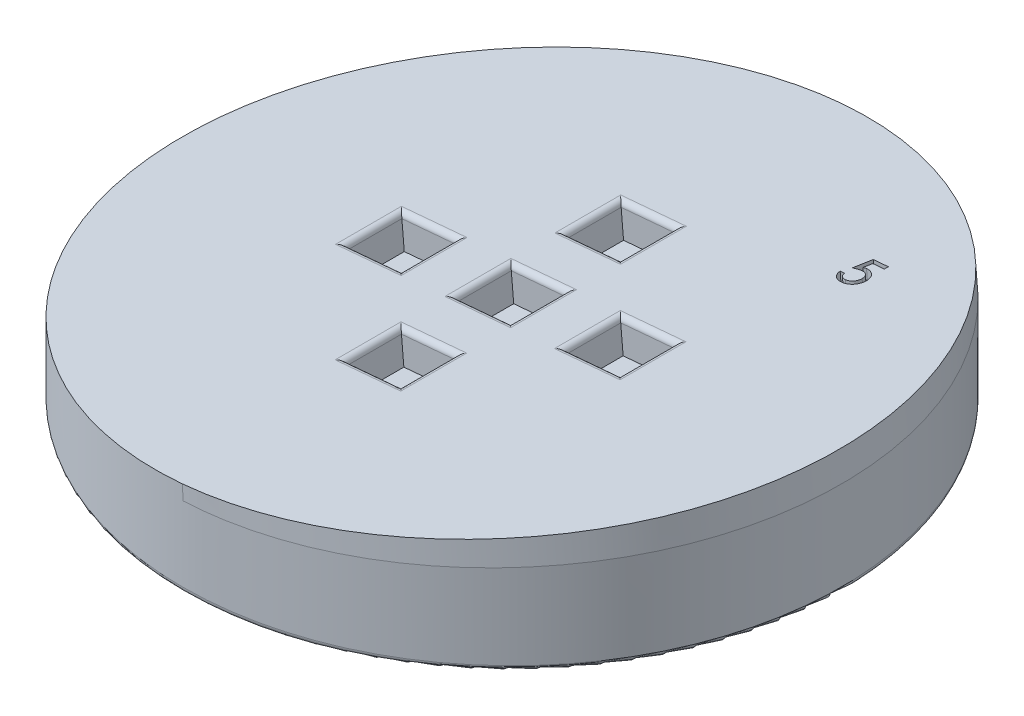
SolidWorks part; units mm, degrees
ref_plane "Front Plane" through (0, 0, 0) normal (0, 0, 1) x (1, 0, 0)
ref_plane "Top Plane" through (0, 0, 0) normal (0, 1, 0) x (1, 0, 0)
ref_plane "Right Plane" through (0, 0, 0) normal (1, 0, 0) x (0, 0, -1)
sketch "Sketch1" plane through (0, 0, 0) normal (0, 1, 0) x (1, 0, 0)
  circle A0 centre (0, 0) radius 30
extrude "Boss-Extrude1" add sketch "Sketch1" along normal blind 50
sketch "Sketch3" plane through (0, 50, 0) normal (0, 1, 0) x (1, 0, 0)
sketch "Sketch4" plane through (0, 0, 0) normal (0, -1, 0) x (-1, 0, 0)
  line L0 (0, 0) -> (-10, 0) construction
  line L1 (0, 0) -> (0, -10) construction
  line L2 (0, 0) -> (0, 10) construction
  line L3 (0, 0) -> (10, 0) construction
  line L5 (-2.5, 2.5) -> (2.5, 2.5)
  line L6 (-2.5, 2.5) -> (-2.5, -2.5)
  line L7 (-2.5, -2.5) -> (2.5, -2.5)
  line L8 (2.5, 2.5) -> (2.5, -2.5)
  line L9 (-2.5, 2.5) -> (2.5, -2.5) construction
  line L10 (-2.5, -2.5) -> (2.5, 2.5) construction
  line L11 (-2.5, -7.5) -> (2.5, -7.5)
  line L12 (-2.5, -7.5) -> (-2.5, -12.5)
  line L13 (-2.5, -12.5) -> (2.5, -12.5)
  line L14 (2.5, -7.5) -> (2.5, -12.5)
  line L15 (-2.5, -7.5) -> (2.5, -12.5) construction
  line L16 (-2.5, -12.5) -> (2.5, -7.5) construction
  line L17 (7.5, 2.5) -> (12.5, 2.5)
  line L18 (7.5, 2.5) -> (7.5, -2.5)
  line L19 (7.5, -2.5) -> (12.5, -2.5)
  line L20 (12.5, 2.5) -> (12.5, -2.5)
  line L21 (7.5, 2.5) -> (12.5, -2.5) construction
  line L22 (7.5, -2.5) -> (12.5, 2.5) construction
  line L23 (-12.5, 2.5) -> (-7.5, 2.5)
  line L24 (-12.5, 2.5) -> (-12.5, -2.5)
  line L25 (-12.5, -2.5) -> (-7.5, -2.5)
  line L26 (-7.5, 2.5) -> (-7.5, -2.5)
  line L27 (-12.5, 2.5) -> (-7.5, -2.5) construction
  line L28 (-12.5, -2.5) -> (-7.5, 2.5) construction
  line L29 (2.5, 7.5) -> (-2.5, 7.5)
  line L30 (2.5, 7.5) -> (2.5, 12.5)
  line L31 (2.5, 12.5) -> (-2.5, 12.5)
  line L32 (-2.5, 7.5) -> (-2.5, 12.5)
  line L33 (2.5, 7.5) -> (-2.5, 12.5) construction
  line L34 (2.5, 12.5) -> (-2.5, 7.5) construction
  dimension "D1" = 5
  dimension "D2" = 5
  dimension "D3" = 5
  dimension "D4" = 5
  dimension "D5" = 5
  dimension "D6" = 5
extrude "Cut-Extrude2" cut sketch "Sketch4" against normal blind 3
fillet "Fillet2" radius 0.5 21 edges at (0, 0, 30) (2.5, 0, 0) (0, 0, 2.5) (-2.5, 0, 0) (0, 0, -2.5) (2.5, 0, 10) (0, 0, 12.5) (-2.5, 0, 10) (0, 0, 7.5) (-7.5, 0, 0) (-10, 0, 2.5) (-12.5, 0, 0) (-10, 0, -2.5) (12.5, 0, 0) (10, 0, 2.5) (7.5, 0, 0) (10, 0, -2.5) (-2.5, 0, -10) (0, 0, -12.5) (2.5, 0, -10) (0, 0, -7.5)
ref_plane "Plane6" through (0, 0, 3.5) normal (0, 0, 1) x (1, 0, 0)
sketch "Sketch13" plane through (0, 0, 3.5) normal (0, 0, 1) x (1, 0, 0)
  line L0 (-30, 6) -> (30, 11.2493)
  line L1 (-30, 50) -> (-30, 0.5) construction
  line L2 (30, 0.5) -> (30, 50) construction
  line L3 (30, 11.2493) -> (30, 50)
  line L4 (30, 50) -> (-30, 50)
  line L5 (-30, 50) -> (-30, 6)
  line L6 (30, 0.5) -> (-30, 0.5) construction
  dimension "D1" = 5.5
  dimension "D2" = 5
extrude "Cut-Extrude10" cut sketch "Sketch13" against normal mid plane 90
ref_plane "Plane4" through (0, 0, -2.5) normal (0, 0, -1) x (-1, 0, 0)
ref_plane "Plane5" through (0, 0, -62.5) normal (0, 0, -1) x (-1, 0, 0)
sketch "Sketch15" plane through (-0.7488, 8.5591, 0) normal (-0.0872, 0.9962, 0) x (0.9962, 0.0872, 0)
  line L0 (-29.3629, 0) -> (0, 0) construction
  line L2 (-6.8629, -2.5) -> (-11.8629, -2.5)
  line L3 (-6.8629, -2.5) -> (-6.8629, 2.5)
  line L4 (-6.8629, 2.5) -> (-11.8629, 2.5)
  line L5 (-11.8629, -2.5) -> (-11.8629, 2.5)
  line L6 (-6.8629, -2.5) -> (-11.8629, 2.5) construction
  line L7 (-6.8629, 2.5) -> (-11.8629, -2.5) construction
  line L8 (3.1371, -2.5) -> (-1.8629, -2.5)
  line L9 (3.1371, -2.5) -> (3.1371, 2.5)
  line L10 (3.1371, 2.5) -> (-1.8629, 2.5)
  line L11 (-1.8629, -2.5) -> (-1.8629, 2.5)
  line L12 (3.1371, -2.5) -> (-1.8629, 2.5) construction
  line L13 (3.1371, 2.5) -> (-1.8629, -2.5) construction
  line L14 (13.1371, -2.5) -> (8.1371, -2.5)
  line L15 (13.1371, -2.5) -> (13.1371, 2.5)
  line L16 (13.1371, 2.5) -> (8.1371, 2.5)
  line L17 (8.1371, -2.5) -> (8.1371, 2.5)
  line L18 (13.1371, -2.5) -> (8.1371, 2.5) construction
  line L19 (13.1371, 2.5) -> (8.1371, -2.5) construction
  line L20 (3.1371, -12.5) -> (-1.8629, -12.5)
  line L21 (3.1371, -12.5) -> (3.1371, -7.5)
  line L22 (3.1371, -7.5) -> (-1.8629, -7.5)
  line L23 (-1.8629, -12.5) -> (-1.8629, -7.5)
  line L24 (3.1371, -12.5) -> (-1.8629, -7.5) construction
  line L25 (3.1371, -7.5) -> (-1.8629, -12.5) construction
  line L26 (3.1371, 7.5) -> (-1.8629, 7.5)
  line L27 (3.1371, 7.5) -> (3.1371, 12.5)
  line L28 (3.1371, 12.5) -> (-1.8629, 12.5)
  line L29 (-1.8629, 7.5) -> (-1.8629, 12.5)
  line L30 (3.1371, 7.5) -> (-1.8629, 12.5) construction
  line L31 (3.1371, 12.5) -> (-1.8629, 7.5) construction
  ellipse E0 centre (0.7517, 0) end of major axis (-29.3629, 0) minor radius 30 construction
  point P9 (-9.3629, 0)
  point P14 (0.6371, 0)
  point P19 (10.6371, 0)
  point P24 (0.6371, -10)
  point P29 (0.6371, 10)
  dimension "D1" = 40
  dimension "D2" = 30
  dimension "D3" = 20
  dimension "D4" = 5
  dimension "D5" = 5
  dimension "D6" = 5
  dimension "D7" = 5
  dimension "D8" = 5
  dimension "D9" = 5
  dimension "D10" = 5
  dimension "D11" = 5
  dimension "D12" = 10
  dimension "D13" = 10
  dimension "D14" = 5
  dimension "D15" = 5
extrude "Cut-Extrude11" cut sketch "Sketch15" against normal blind 3
ref_plane "Plane7" through (0, 0, 0) normal (0, 0, -1) x (-1, 0, 0)
sketch "Sketch24" plane through (-0.7488, 8.5591, 0) normal (-0.0872, 0.9962, 0) x (0.9962, 0.0872, 0)
  line L0 (0.6371, -30) -> (35.1643, -35.8499)
  line L1 (0.6371, 0) -> (-29.3629, 0)
  line L3 (35.1643, -35.8499) -> (45.7239, 0)
  line L4 (45.7239, 0) -> (28.8644, 38.5482)
  line L5 (28.8644, 38.5482) -> (0.6371, 34.4662)
  line L6 (0.6371, 34.4662) -> (0.6371, 30)
  arc A0 (0.6371, -30) -> (-29.3629, 0) centre (0.6371, 0) ccw
  ellipse E1 centre (0.7517, 0) end of major axis (-29.3629, 0) minor radius 30 construction
  dimension "D1" = 30
extrude "Cut-Extrude13" cut sketch "Sketch24" against normal blind 100 contours A0 M21
fillet "Fillet8" radius 0.5 4 edges at (-0.1142, 8.6147, -7.5) (2.3763, 8.8326, -10) (-0.1142, 8.6147, -12.5) (-2.6046, 8.3968, -10)
fillet "Fillet9" radius 0.5 4 edges at (9.8478, 9.4862, 2.5) (12.3383, 9.7041, 0) (9.8478, 9.4862, -2.5) (7.3573, 9.2683, 0)
fillet "Fillet10" radius 0.5 4 edges at (-12.5666, 7.5252, 0) (-10.0761, 7.7431, 2.5) (-7.5856, 7.961, 0) (-10.0761, 7.7431, -2.5)
fillet "Fillet11" radius 0.5 4 edges at (-2.6046, 8.3968, 10) (-0.1142, 8.6147, 12.5) (2.3763, 8.8326, 10) (-0.1142, 8.6147, 7.5)
fillet "Fillet12" radius 0.5 4 edges at (-2.6046, 8.3968, 0) (-0.1142, 8.6147, 2.5) (2.3763, 8.8326, 0) (-0.1142, 8.6147, -2.5)
sketch "Sketch25" plane through (-0.7488, 8.5591, 0) normal (-0.0872, 0.9962, 0) x (0.9962, 0.0872, 0)
  text T0 "<b>5</b>"
extrude "Cut-Extrude14" cut sketch "Sketch25" against normal blind 4
